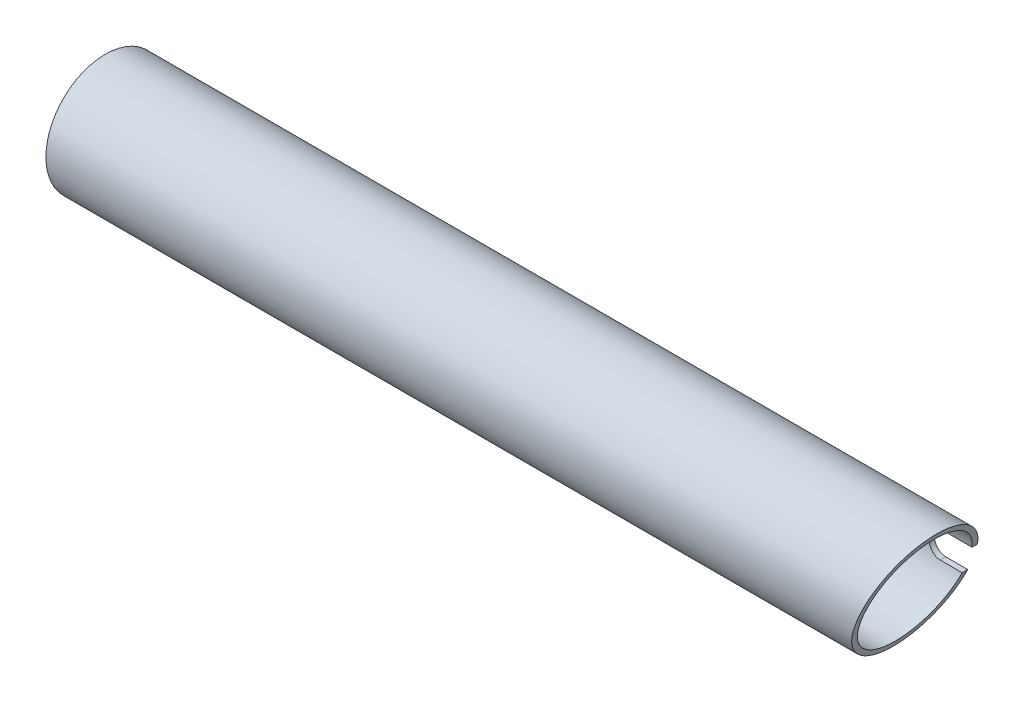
SolidWorks part; units mm, degrees
ref_plane "Plan de face" through (0, 0, 0) normal (0, 0, 1) x (1, 0, 0)
ref_plane "Plan de dessus" through (0, 0, 0) normal (0, 1, 0) x (1, 0, 0)
ref_plane "Plan de droite" through (0, 0, 0) normal (1, 0, 0) x (0, 0, -1)
sketch "Esquisse1" plane through (0, 0, 0) normal (1, 0, 0) x (0, 0, -1)
  circle A0 centre (0, 0) radius 11
  dimension "D1" = 22
extrude "Extru.-Mince1" add sketch "Esquisse1" along normal blind 160 thin
sketch "Esquisse2" plane through (0, 0, 0) normal (0, 0, 1) x (1, 0, 0)
  line L0 (154.0037, 11) -> (145.9963, -11)
  line L1 (160, 11) -> (0, 11) construction
  line L2 (0, -11) -> (160, -11) construction
  line L3 (-3.515, 0) -> (176.7095, 0) construction
  line L5 (0, 11) -> (0, -11) construction
  point P13 (150, 0)
  dimension "D1" = 150
  dimension "D2" = 70
extrude "Enlèv. mat.-Extru.1" cut sketch "Esquisse2" against normal through all and the other way through all
sketch "Esquisse3" plane through (0, 0, 0) normal (0, 0, 1) x (1, 0, 0)
  line L0 (150.9099, 2.5) -> (145, 2.5)
  line L1 (145.9963, -11) -> (154.0037, 11) construction
  line L2 (145, -2.5) -> (149.0901, -2.5)
  line L3 (149.0901, -2.5) -> (150.9099, 2.5)
  arc A0 (145, 2.5) -> (145, -2.5) centre (145, 0) ccw
  point P6 (150, 0)
  dimension "D1" = 2.5
  dimension "D2" = 5
extrude "Enlèv. mat.-Extru.2" cut sketch "Esquisse3" against normal through all
